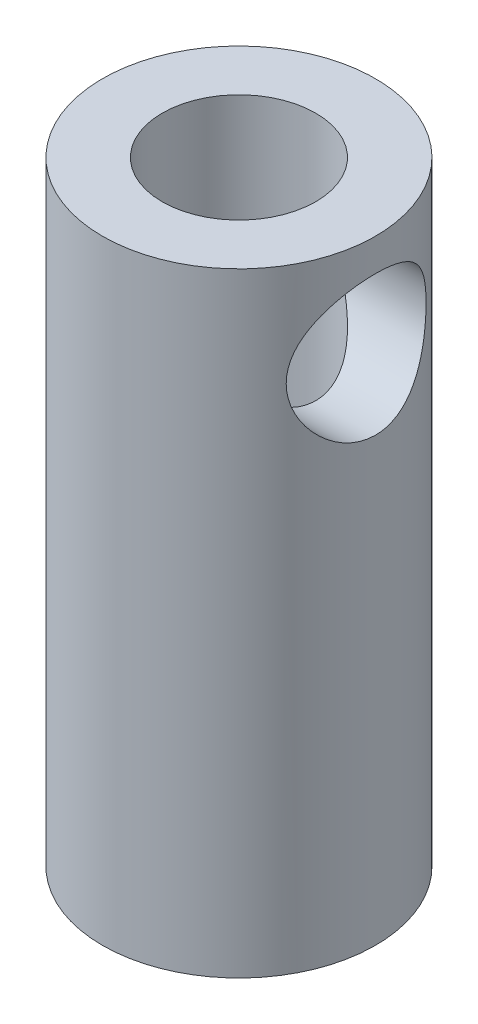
SolidWorks part; units mm, degrees
ref_plane "Front Plane" through (0, 0, 0) normal (0, 0, 1) x (1, 0, 0)
ref_plane "Top Plane" through (0, 0, 0) normal (0, 1, 0) x (1, 0, 0)
ref_plane "Right Plane" through (0, 0, 0) normal (1, 0, 0) x (0, 0, -1)
sketch "Sketch1" plane through (0, 0, 0) normal (0, 1, 0) x (1, 0, 0)
  circle A0 centre (0, 0) radius 4
  dimension "D1" = 8
extrude "Boss-Extrude1" add sketch "Sketch1" along normal blind 18
sketch "Sketch2" plane through (0, 0, 0) normal (0, -1, 0) x (1, 0, 0)
  circle A0 centre (0, 0) radius 2.25
  dimension "D1" = 4.5
extrude "Cut-Extrude1" cut sketch "Sketch2" against normal through all
hole_wizard "Ø4.1 (4.1) Diameter Hole1" positions "Sketch5" profile "Sketch4" hole size "Ø4.1" standard "ANSI Metric"
sketch "Sketch5" plane through (0, 0, 0) normal (1, 0, 0) x (0, 0, -1)
  line L0 (0, 15) -> (0, 0) construction
  point P0 (0, 15)
  dimension "D1" = 15
sketch "Sketch4" plane through (0, 15, 0) normal (0, 1, 0) x (0, 0, 1)
  line L0 (0, 0) -> (0, 4)
  line L1 (0, 4) -> (2.05, 4)
  line L2 (2.05, 4) -> (2.05, 0)
  line L5 (2.05, 0) -> (0, 0)
  line L11 (0, -6.35) -> (0, 107.95) construction
  dimension "Thru Hole Dia." = 4.1
  dimension "Thru Hole Depth" = 4
